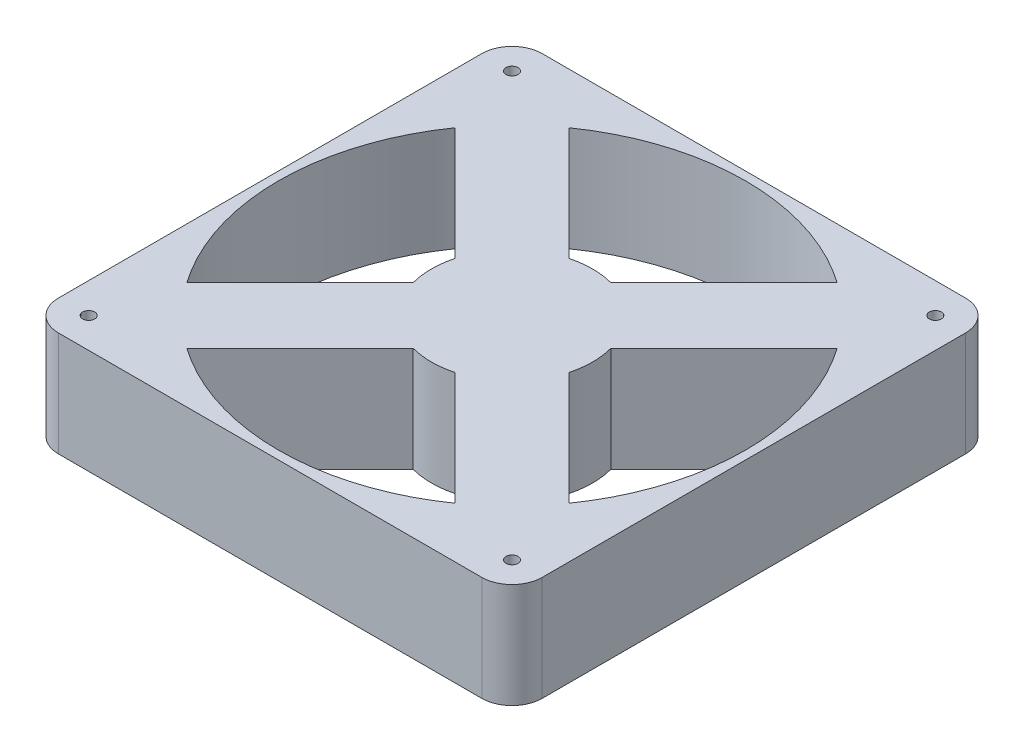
SolidWorks part; units mm, degrees
ref_plane "Ebene vorne" through (0, 0, 0) normal (0, 0, 1) x (1, 0, 0)
ref_plane "Ebene oben" through (0, 0, 0) normal (0, 1, 0) x (1, 0, 0)
ref_plane "Ebene rechts" through (0, 0, 0) normal (1, 0, 0) x (0, 0, -1)
sketch "Skizze1" plane through (0, 0, 0) normal (0, 1, 0) x (1, 0, 0)
  line L0 (0, 38.7044) -> (0, -44.2336) construction
  line L1 (-50.4133, 0) -> (52.69, 0) construction
  line L2 (-52.5, 52.5) -> (-51.4393, 51.4393) construction
  line L3 (-52.5, 60) -> (52.5, 60)
  line L4 (-60, 52.5) -> (-60, -52.5)
  line L5 (-52.5, -60) -> (52.5, -60)
  line L6 (60, 52.5) -> (60, -52.5)
  line L7 (19.3185, -5.1764) -> (47.393, -33.2508)
  line L8 (-47.393, 33.2508) -> (-19.3185, 5.1764)
  line L9 (19.3185, 5.1764) -> (47.393, 33.2508)
  line L10 (-33.2508, 47.393) -> (-5.1764, 19.3185)
  line L11 (52.5, 52.5) -> (-52.5, -52.5) construction
  line L12 (-40.9372, 40.9372) -> (40.9372, -40.9372) construction
  line L13 (51.4393, -51.4393) -> (52.5, -52.5) construction
  line L14 (-19.3185, -5.1764) -> (-47.393, -33.2508)
  line L15 (5.1764, 19.3185) -> (33.2508, 47.393)
  line L16 (5.1764, -19.3185) -> (33.2508, -47.393)
  line L17 (-5.1764, -19.3185) -> (-33.2508, -47.393)
  arc A0 (-33.2508, -47.393) -> (33.2508, -47.393) centre (0, 0) ccw
  arc A1 (-60, -52.5) -> (-52.5, -60) centre (-52.5, -52.5) ccw
  arc A2 (52.5, -60) -> (60, -52.5) centre (52.5, -52.5) ccw
  arc A3 (52.5, 60) -> (60, 52.5) centre (52.5, 52.5) cw
  arc A4 (-60, 52.5) -> (-52.5, 60) centre (-52.5, 52.5) cw
  circle A5 centre (-52.5, 52.5) radius 1.5
  circle A6 centre (52.5, 52.5) radius 1.5
  circle A7 centre (-52.5, -52.5) radius 1.5
  circle A8 centre (52.5, -52.5) radius 1.5
  arc A9 (-19.3185, 5.1764) -> (-19.3185, -5.1764) centre (0, 0) ccw
  arc A10 (-47.393, 33.2508) -> (-47.393, -33.2508) centre (0, 0) ccw
  arc A11 (19.3185, 5.1764) -> (19.3185, -5.1764) centre (0, 0) cw
  arc A12 (47.393, 33.2508) -> (47.393, -33.2508) centre (0, 0) cw
  arc A13 (-5.1764, -19.3185) -> (5.1764, -19.3185) centre (0, 0) ccw
  arc A14 (-33.2508, 47.393) -> (33.2508, 47.393) centre (0, 0) cw
  arc A15 (-5.1764, 19.3185) -> (5.1764, 19.3185) centre (0, 0) cw
  point P13 (-60, -60)
  point P18 (60, 60)
  point P21 (-60, 60)
  dimension "D3" = 7.5
  dimension "D4" = 3
  dimension "D5" = 40
  dimension "D1" = 120
  dimension "D2" = 120
extrude "Aufsatz-Linear austragen1" add sketch "Skizze1" along normal blind 26
